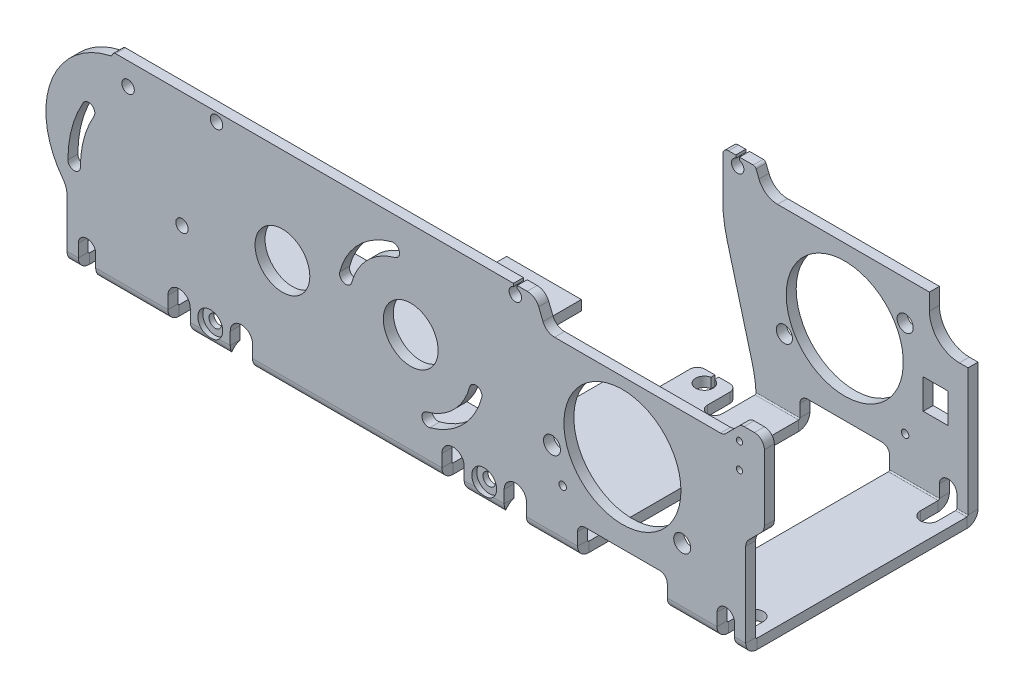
SolidWorks part; units mm, degrees
extrude "Base-Extrusion" add sketch "Esquisse1" along normal blind 4
sketch "Esquisse1" plane through (0, 0, 0) normal (0, 0, 1) x (1, 0, 0)
  line L0 (-173.9051, 0) -> (3.9051, 0) construction
  line L1 (0, 18) -> (0, -172.2) construction
  line L2 (-27.25, 28) -> (39.3787, 28)
  line L3 (57, 31) -> (57, 4.5)
  line L4 (-203.4968, 38.5) -> (-43.75, 38.5)
  line L5 (-43, 55) -> (-43, 28) construction
  line L6 (-50, 35) -> (-35.5, 35) construction
  line L7 (49.5, -6.3137) -> (49.5, -183.3)
  line L8 (-31.8811, 31.1152) -> (-33.6189, 35.3848)
  line L9 (50.6716, -3.4853) -> (55.8284, 1.6716)
  line L10 (41.5, 28.8787) -> (46.7426, 34.1213)
  line L11 (48.864, 35) -> (53, 35)
  line L12 (-223, -42) -> (-18, -42) construction
  line L13 (-198.4968, 49.5) -> (-198.4968, -34.5) construction
  line L14 (-212.584, 4.5) -> (-178, 4.5) construction
  line L15 (-223, -20.4908) -> (-223, -97)
  line L16 (-42.25, 37.3848) -> (-42.25, 38.5)
  line L17 (-220.1474, 17) -> (-165.036, -14.8186) construction
  line L18 (-198.4968, 4.5) -> (-230.1097, -13.7517) construction
  line L19 (-175.5, 35) -> (-124, 35) construction
  line L20 (-163, 55) -> (-163, 29.5) construction
  line L21 (-85, 20.5) -> (-85, -32) construction
  line L22 (-136.52, 14.9006) -> (-136.52, -34.5) construction
  line L23 (-231, -35) -> (61, -35) construction
  line L24 (-215, -35) -> (-215, -51.1) construction
  line L25 (-218.5, -35) -> (-218.5, -51.1)
  line L26 (-211.5, -35) -> (-211.5, -51.1)
  line L27 (-178, -32) -> (-178, -51.1) construction
  line L28 (-153, -32) -> (-153, -51.1) construction
  line L29 (-182.4755, -35) -> (-182.4755, -51.1)
  line L30 (-148.5245, -35) -> (-148.5245, -51.1)
  line L31 (-157.4755, -35) -> (-157.4755, -40)
  line L32 (-173.5245, -35) -> (-173.5245, -40)
  line L33 (-170.5245, -43) -> (-160.4755, -43)
  line L34 (-172.8871, -36.5) -> (-53, -36.5) construction
  line L35 (-165.4956, -43) -> (-165.4956, -24) construction
  line L36 (-68, -29.5) -> (-68, -51.1) construction
  line L37 (-18, -137.2) -> (-18, -35)
  line L38 (-15, -32) -> (15, -32)
  line L39 (-43, -26.932) -> (-43, -51.1) construction
  line L40 (-63.5245, -35) -> (-63.5245, -40)
  line L41 (-60.5245, -43) -> (-50.4755, -43)
  line L42 (-47.4755, -40) -> (-47.4755, -35)
  line L43 (-68, -55.5755) -> (-43, -55.5755)
  line L44 (18, -35) -> (18, -137.2)
  line L45 (18, -42) -> (49.5, -42) construction
  line L46 (41.5, -30.7923) -> (41.5, -66.5) construction
  line L47 (38, -35) -> (38, -51.1)
  line L48 (45, -35) -> (45, -51.1)
  line L49 (-85, 0) -> (-66.6118, 18.3882) construction
  line L50 (-242, -130.2) -> (66, -130.2) construction
  line L52 (-49.7255, -172.2) -> (75, -172.2) construction
  line L53 (-74, -86.1) -> (66, -86.1) construction
  line L54 (-15, -140.2) -> (15, -140.2)
  line L55 (45, -137.2) -> (45, -121.1)
  line L56 (38, -137.2) -> (38, -121.1)
  line L57 (-26.9927, -201.9) -> (34, -201.9)
  line L58 (-46.6755, -210.7) -> (-43.75, -210.7)
  line L59 (-35.586, -209.9057) -> (-34.4422, -206.9838)
  line L60 (-48.9755, -192.4047) -> (-48.9755, -208.4)
  line L61 (-47.2718, -179.4637) -> (-37.2282, -141.9804)
  line L62 (34, -195.3) -> (34, -201.9)
  line L63 (-223, -97) -> (-133.5245, -97)
  line L64 (-223, -51.1) -> (49.5, -51.1) construction
  line L65 (-38.5245, -35) -> (-38.5245, -51.1)
  line L66 (-178, -55.5755) -> (-153, -55.5755)
  line L67 (-72.4755, -35) -> (-72.4755, -51.1)
  line L68 (-35.5245, -129.0394) -> (-35.5245, -115.1)
  line L69 (-55.5, -43) -> (-55.5, -32.5) construction
  line L70 (-43.75, 37.3848) -> (-43.75, 38.5)
  line L71 (-42.25, 38.5) -> (-38.25, 38.5)
  line L72 (-43.75, -209.5848) -> (-43.75, -210.7)
  line L73 (-42.25, -209.5848) -> (-42.25, -210.7)
  line L74 (-42.25, -210.7) -> (-36.75, -210.7)
  line L75 (47, 52) -> (47, 3) construction
  line L76 (43.5, 29) -> (52, 29) construction
  line L77 (37, 19) -> (55, 19) construction
  line L78 (-38.5245, -103.5) -> (-38.5245, -122.5) construction
  line L79 (41.5, -121.1) -> (-18, -121.1) construction
  line L80 (-41.5245, -115.1) -> (-41.5245, -124.1)
  line L81 (-48.9755, -125.5187) -> (-48.9755, -127.1)
  line L82 (-57.5245, -124.1) -> (-57.5245, -106)
  line L83 (-57.5245, -106) -> (-70.5245, -106)
  line L84 (-70.5245, -106) -> (-70.5245, -68)
  line L85 (-70.5245, -68) -> (-103.5245, -68)
  line L86 (-103.5245, -68) -> (-103.5245, -126.5)
  line L87 (-103.5245, -126.5) -> (-133.5245, -126.5)
  line L88 (-133.5245, -126.5) -> (-133.5245, -97)
  line L89 (-49.7255, -124) -> (-49.7255, -114.5) construction
  line L90 (-50.4755, -125.5187) -> (-50.4755, -127.1)
  line L91 (-50.4755, -127.1) -> (-54.5245, -127.1)
  line L92 (-44.5245, -127.1) -> (-48.9755, -127.1)
  line L93 (-41.5245, -22) -> (-0.9476, -22) construction
  line L94 (26.5573, -17) -> (-3.6626, -17) construction
  line L95 (-24, 8.5) -> (-24, -35) construction
  line L96 (36.5, -159.2) -> (36.5, -178) construction
  line L97 (31.5, -171.2) -> (41.5, -171.2)
  line L98 (31.5, -171.2) -> (31.5, -159.2)
  line L99 (31.5, -159.2) -> (41.5, -159.2)
  line L100 (41.5, -171.2) -> (41.5, -159.2)
  line L101 (46, -183.3) -> (49.5, -183.3)
  line L102 (-24.2487, -158.2) -> (34.4391, -192.0834) construction
  line L103 (-85, 0) -> (-111.9237, 7.2142) construction
  line L104 (-85, 0) -> (-91.9881, 26.08) construction
  circle A0 centre (0, 0) radius 23.5
  arc A1 (-43.75, 37.3848) -> (-42.25, 37.3848) centre (-43, 35) ccw
  arc A2 (-33.6189, 35.3848) -> (-38.25, 38.5) centre (-38.25, 33.5) ccw
  arc A3 (-27.25, 28) -> (-31.8811, 31.1152) centre (-27.25, 33) cw
  arc A4 (41.5, 28.8787) -> (39.3787, 28) centre (39.3787, 31) cw
  arc A5 (48.864, 35) -> (46.7426, 34.1213) centre (48.864, 32) ccw
  arc A6 (57, 31) -> (53, 35) centre (53, 31) ccw
  arc A7 (55.8284, 1.6716) -> (57, 4.5) centre (53, 4.5) ccw
  arc A8 (49.5, -6.3137) -> (50.6716, -3.4853) centre (53.5, -6.3137) cw
  arc A9 (-205.6294, 36.72) -> (-224.6579, -15.6146) centre (-198.4968, 4.5) ccw
  arc A10 (-204.6982, 37.5952) -> (-205.6294, 36.72) centre (-205.8996, 37.9404) cw
  arc A11 (-203.4968, 38.5) -> (-204.6982, 37.5952) centre (-203.4968, 37.25) ccw
  arc A12 (-223, -20.4908) -> (-224.6579, -15.6146) centre (-231, -20.4908) ccw
  circle A13 centre (-198.4968, 4.5) radius 25 construction
  circle A14 centre (-176.8462, -8) radius 2.5
  circle A15 centre (-163, 35) radius 2.5
  circle A16 centre (-198.4968, 29.5) radius 2.5
  arc A17 (-220.1474, -8) -> (-214.3462, 13.6506) centre (-176.8462, -8) cw construction
  arc A18 (-212.1811, 12.4006) -> (-216.5112, 14.9006) centre (-214.3462, 13.6506) ccw
  arc A19 (-222.6474, -8) -> (-216.5112, 14.9006) centre (-176.8462, -8) cw
  arc A20 (-217.6474, -8) -> (-212.1811, 12.4006) centre (-176.8462, -8) cw
  arc A21 (-222.6474, -8) -> (-217.6474, -8) centre (-220.1474, -8) ccw
  circle A22 centre (-136.52, 0) radius 11
  circle A23 centre (-85, 0) radius 11
  arc A24 (-211.5, -35) -> (-218.5, -35) centre (-215, -35) ccw
  arc A25 (-173.5245, -35) -> (-182.4755, -35) centre (-178, -35) ccw
  arc A26 (-148.5245, -35) -> (-157.4755, -35) centre (-153, -35) ccw
  arc A27 (-170.5245, -43) -> (-173.5245, -40) centre (-170.5245, -40) cw
  arc A28 (-157.4755, -40) -> (-160.4755, -43) centre (-160.4755, -40) cw
  circle A29 centre (-165.4956, -36.5) radius 2.5
  arc A30 (-72.4755, -35) -> (-63.5245, -35) centre (-68, -35) cw
  arc A31 (-47.4755, -35) -> (-38.5245, -35) centre (-43, -35) cw
  arc A32 (-72.4755, -51.1) -> (-68, -55.5755) centre (-68, -51.1) ccw
  arc A33 (-38.5245, -51.1) -> (-43, -55.5755) centre (-43, -51.1) cw
  circle A34 centre (-55.5, -36.5) radius 2.5
  arc A35 (-15, -32) -> (-18, -35) centre (-15, -35) ccw
  arc A36 (18, -35) -> (15, -32) centre (15, -35) ccw
  arc A37 (38, -35) -> (45, -35) centre (41.5, -35) cw
  arc A38 (-89.5459, 26.6146) -> (-111.6146, 4.5459) centre (-85, 0) ccw construction
  arc A39 (-113.4948, 7.6352) -> (-108.6652, 6.3411) centre (-111.08, 6.9881) ccw
  arc A40 (-91.3411, 23.6652) -> (-92.6352, 28.4948) centre (-91.9881, 26.08) ccw
  arc A41 (-113.4948, 7.6352) -> (-92.6352, 28.4948) centre (-85, 0) cw
  arc A42 (-108.6652, 6.3411) -> (-91.3411, 23.6652) centre (-85, 0) cw
  arc A43 (-61.3348, -6.3411) -> (-56.5052, -7.6352) centre (-58.92, -6.9881) cw
  arc A44 (-77.3648, -28.4948) -> (-56.5052, -7.6352) centre (-85, 0) ccw
  arc A45 (-78.6589, -23.6652) -> (-61.3348, -6.3411) centre (-85, 0) ccw
  arc A46 (-77.3648, -28.4948) -> (-78.6589, -23.6652) centre (-78.0119, -26.08) cw
  arc A47 (18, -137.2) -> (15, -140.2) centre (15, -137.2) cw
  arc A48 (-15, -140.2) -> (-18, -137.2) centre (-15, -137.2) cw
  arc A49 (38, -51.1) -> (45, -51.1) centre (41.5, -51.1) ccw
  arc A50 (38, -137.2) -> (45, -137.2) centre (41.5, -137.2) ccw
  arc A51 (38, -121.1) -> (45, -121.1) centre (41.5, -121.1) cw
  circle A52 centre (0, -172.2) radius 23.5
  arc A53 (-43.75, -209.5848) -> (-42.25, -209.5848) centre (-43, -207.2) cw
  arc A54 (-26.9927, -201.9) -> (-34.4422, -206.9838) centre (-26.9927, -209.9) ccw
  arc A55 (-35.586, -209.9057) -> (-36.75, -210.7) centre (-36.75, -209.45) cw
  arc A56 (-46.6755, -210.7) -> (-48.9755, -208.4) centre (-46.6755, -208.4) cw
  arc A57 (-47.2718, -179.4637) -> (-48.9755, -192.4047) centre (1.0245, -192.4047) ccw
  arc A58 (-35.5245, -129.0394) -> (-37.2282, -141.9804) centre (-85.5245, -129.0394) cw
  arc A59 (34, -195.3) -> (46, -183.3) centre (46, -195.3) cw
  arc A60 (-211.5, -51.1) -> (-218.5, -51.1) centre (-215, -51.1) cw
  arc A61 (-182.4755, -51.1) -> (-178, -55.5755) centre (-178, -51.1) ccw
  arc A62 (-148.5245, -51.1) -> (-153, -55.5755) centre (-153, -51.1) cw
  arc A63 (-60.5245, -43) -> (-63.5245, -40) centre (-60.5245, -40) cw
  arc A64 (-47.4755, -40) -> (-50.4755, -43) centre (-50.4755, -40) cw
  circle A65 centre (47, 29) radius 1.25
  circle A66 centre (47, 19) radius 1.25
  arc A67 (-35.5245, -115.1) -> (-41.5245, -115.1) centre (-38.5245, -115.1) ccw
  arc A68 (-44.5245, -127.1) -> (-41.5245, -124.1) centre (-44.5245, -124.1) ccw
  arc A69 (-57.5245, -124.1) -> (-54.5245, -127.1) centre (-54.5245, -124.1) ccw
  arc A70 (-48.9755, -125.5187) -> (-50.4755, -125.5187) centre (-49.7255, -122.1) ccw
  circle A71 centre (0, -172.2) radius 28 construction
  circle A72 centre (0, 0) radius 30 construction
  arc A74 (-31.0579, -22) -> (-25.9637, 6.8187) centre (24.7184, -17) cw construction
  circle A76 centre (24.2487, -186.2) radius 3.25
  circle A77 centre (-24, -22) radius 1.5
  circle A78 centre (24.2487, -147.7) radius 1.5
  circle A79 centre (-24.2487, -158.2) radius 3.25
  point P48 (-198.4968, 37.5)
  dimension "D1" = 47
  dimension "D7" = 5
  dimension "D10" = 5
  dimension "D8" = 49.5
  dimension "D12" = 4.5
  dimension "D14" = 1.25
  dimension "D15" = 8
  dimension "D17" = 50
  dimension "D18" = 5
  dimension "D19" = 35
  dimension "D23" = 22
  dimension "D24" = 22
  dimension "D27" = 25
  dimension "D28" = 68
  dimension "D29" = 18
  dimension "D31" = 3
  dimension "D35" = 27
  dimension "D36" = 45
  dimension "D37" = 2.5
  dimension "D38" = 88.2
  dimension "D39" = 29.7
  dimension "D41" = 1.25
  dimension "D42" = 2.3
  dimension "D43" = 50
  dimension "D47" = 3
  dimension "D49" = 8
  dimension "D54" = 5
  dimension "D55" = 33
  dimension "D60" = 2.5
  dimension "D63" = 35
  dimension "D65" = 30
  dimension "D67" = 1.5
  dimension "D68" = 7
  dimension "D72" = 3
  dimension "D73" = 60
  dimension "D74" = 17
  dimension "D80" = 3
  dimension "D85" = 12
  dimension "D86" = 56
  dimension "D88" = 6.5
  dimension "D89" = 6.6
  dimension "D90" = 3
  dimension "D91" = 43.3013
  dimension "D93" = 3.5
  dimension "D94" = 3.5
  dimension "D95" = 256.5
  dimension "D99" = 109.9956
  dimension "D100" = 3
  dimension "D16" = 2.5
  dimension "D21" = 85
  dimension "D102" = 112.146
  dimension "D103" = 4
  dimension "D105" = 3
  dimension "D108" = 4
  dimension "D2" = 28
  dimension "D3" = 57
  dimension "D4" = 38.5
  dimension "D5" = 43
  dimension "D6" = 35
  dimension "D9" = 42
  dimension "D13" = 223
  dimension "D20" = 120
  dimension "D22" = 51.52
  dimension "D25" = 25
  dimension "D26" = 178
  dimension "D30" = 36
  dimension "D32" = 8
  dimension "D33" = 15
  dimension "D34" = 15
  dimension "D40" = 44.1
  dimension "D44" = 34
  dimension "D45" = 55
  dimension "D46" = 35
  dimension "D48" = 10
  dimension "D50" = 35
  dimension "D51" = 8
  dimension "D52" = 8
  dimension "D53" = 1.5
  dimension "D56" = 0.75
  dimension "D57" = 1.5
  dimension "D58" = 6
  dimension "D59" = 10
  dimension "D61" = 17.5245
  dimension "D62" = 3
  dimension "D64" = 22
  dimension "D66" = 68
  dimension "D69" = 36
  dimension "D70" = 5
  dimension "D71" = 0.75
  dimension "D78" = 22
  dimension "D79" = 24
  dimension "D81" = 36.5
  dimension "D82" = 10
  dimension "D83" = 12
  dimension "D84" = 1
  dimension "D87" = 30
  dimension "D92" = 30
  dimension "D96" = 29.5
  dimension "D97" = 29
  dimension "D98" = 102.2
  dimension "D101" = 5
  dimension "D104" = 135
  dimension "D106" = 135
  dimension "D107" = 7
  dimension "D109" = 111.378
  dimension "D110" = 5.5
  dimension "D111" = 4
  dimension "D112" = 15
  dimension "D113" = 15.9953
  dimension "D114" = 7
  dimension "D115" = 38
  dimension "D116" = 25.2513
  dimension "D117" = 7.5
  dimension "D118" = 61.9768
bend "Pli défini à plat4" bend radius 0.5 bend angle 90 parameters "D5"=1, "RD2"=79.0365
bend "Pli défini à plat5" bend radius 0.5 bend angle 90 parameters "D5"=2, "RD3"=4.0365, "RD4"=85.273
ref_plane "Plan1" through (0, 0, 0) normal (0, 0, 1) x (1, 0, 0)
ref_plane "Plan2" through (0, 0, 0) normal (0, 1, 0) x (1, 0, 0)
ref_plane "Plan3" through (0, 0, 0) normal (1, 0, 0) x (0, 0, -1)
sheet metal parameters "Tôlerie 1" parameters "D1"=0.5
flatten bends "Dépliage 1" parameters "D1"=0
sketch "Esquisse-Angle1" plane through (0, 0, 4) normal (0, 0, 1) x (1, 0, 0)
process bends "Pliage 1" parameters "D1"=0
sketch "Esquisse-Plate1" plane through (0, 0, 4) normal (0, 0, 1) x (1, 0, 0)
  line L2 (-251.7462, -42) -> (66.5, -42) construction
  line L4 (-250, -130.2) -> (70, -130.2) construction
  point P0 (47.25, -41.1)
sketch "Esquisse2" plane through (0, 0, 4) normal (0, 0, 1) x (1, 0, 0)
  circle A0 centre (-165.4956, -36.5) radius 4.9956
  circle A1 centre (-55.5, -36.5) radius 5
extrude "Enlèv. mat.-Extru.1" cut sketch "Esquisse2" against normal blind 2
hole_wizard "Trou taraudé M8x1.251" positions "Esquisse4" profile "Esquisse3" tap size "M8x1.25" standard "ISO"
sketch "Esquisse4" plane through (0, 0, 4) normal (0, 0, 1) x (1, 0, 0)
  circle A0 centre (-28.2843, -10) radius 4.25 construction
  point P0 (-28.2843, -10)
sketch "Esquisse3" plane through (-28.2843, -10, 4) normal (1, 0, 0) x (0, -1, 0)
  line L0 (0, 0) -> (0, 4)
  line L1 (0, 4) -> (3.4, 4)
  line L2 (3.4, 4) -> (3.4, 0)
  line L5 (3.4, 0) -> (0, 0)
  line L11 (0, -6.35) -> (0, 107.95) construction
  dimension "Diamètre du trou pour taraudage jusqu'au prochain" = 6.8
  dimension "Profondeur du trou pour taraudage jusqu'au prochain" = 4
hole_wizard "Trou taraudé M8x1.252" positions "Esquisse6" profile "Esquisse5" tap size "M8x1.25" standard "ISO"
sketch "Esquisse6" plane through (0, 0, 4) normal (0, 0, 1) x (1, 0, 0)
  circle A0 centre (24, -18) radius 4.25 construction
  point P0 (24, -18)
sketch "Esquisse5" plane through (24, -18, 4) normal (1, 0, 0) x (0, -1, 0)
  line L0 (0, 0) -> (0, 4)
  line L1 (0, 4) -> (3.4, 4)
  line L2 (3.4, 4) -> (3.4, 0)
  line L5 (3.4, 0) -> (0, 0)
  line L11 (0, -6.35) -> (0, 107.95) construction
  dimension "Diamètre du trou pour taraudage jusqu'au prochain" = 6.8
  dimension "Profondeur du trou pour taraudage jusqu'au prochain" = 4
